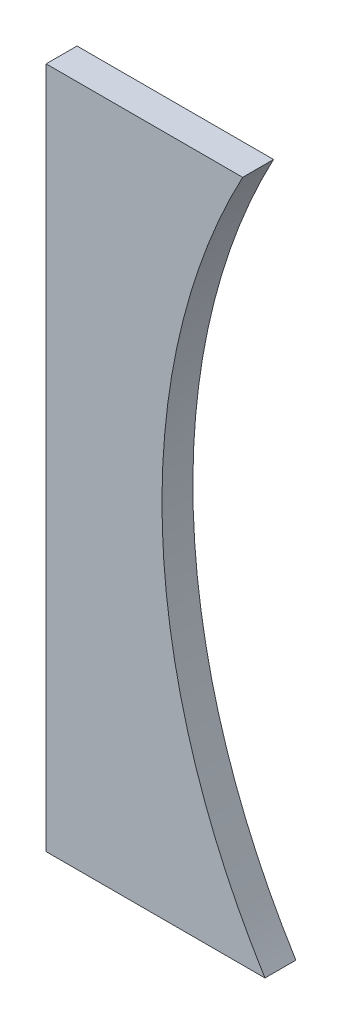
SolidWorks part; units mm, degrees
ref_plane "Plan de face" through (0, 0, 0) normal (0, 0, 1) x (1, 0, 0)
ref_plane "Plan de dessus" through (0, 0, 0) normal (0, 1, 0) x (1, 0, 0)
ref_plane "Plan de droite" through (0, 0, 0) normal (1, 0, 0) x (0, 0, -1)
sketch "Esquisse1" plane through (0, 0, 0) normal (0, 0, 1) x (1, 0, 0)
  line L0 (0, 0) -> (-85, 0)
  line L1 (-85, 0) -> (-85, 265)
  line L2 (-85, 265) -> (-8.6664, 265)
  arc A0 (-8.6664, 265) -> (0, 0) centre (225, 140) ccw
  dimension "D2" = 265
  dimension "D1" = 265
  dimension "D3" = 310
  dimension "D4" = 140
extrude "Extrusion1" add sketch "Esquisse1" along normal blind 12
